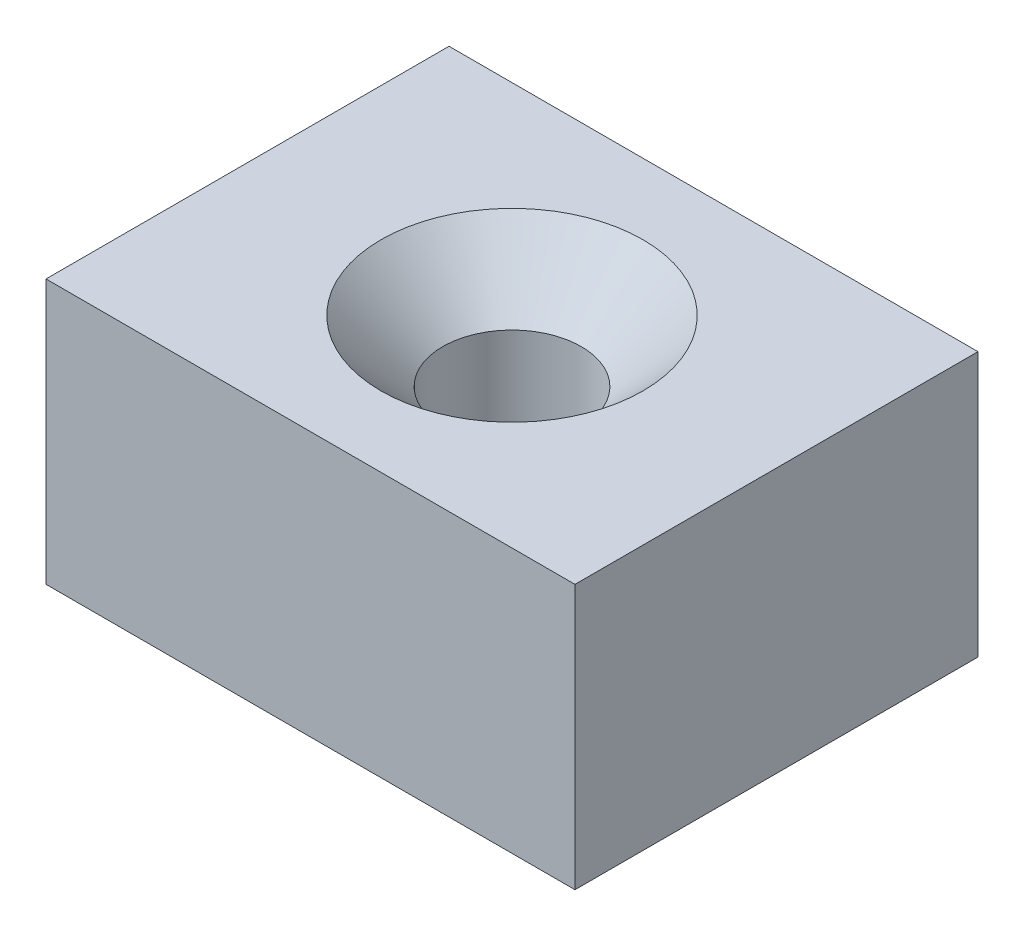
SolidWorks part; units mm, degrees
ref_plane "Front Plane" through (0, 0, 0) normal (0, 0, 1) x (1, 0, 0)
ref_plane "Top Plane" through (0, 0, 0) normal (0, 1, 0) x (1, 0, 0)
ref_plane "Right Plane" through (0, 0, 0) normal (1, 0, 0) x (0, 0, -1)
sketch "Sketch1" plane through (0, 0, 0) normal (0, 0, 1) x (1, 0, 0)
  line L1 (-10.5, 5.25) -> (10.5, 5.25)
  line L2 (-10.5, 5.25) -> (-10.5, -5.25)
  line L3 (-10.5, -5.25) -> (10.5, -5.25)
  line L4 (10.5, 5.25) -> (10.5, -5.25)
  line L5 (-10.5, 5.25) -> (10.5, -5.25) construction
  line L6 (-10.5, -5.25) -> (10.5, 5.25) construction
  point P0 (0, 0)
  dimension "D1" = 21
  dimension "D2" = 10.5
extrude "Boss-Extrude1" add sketch "Sketch1" along normal blind 16
hole_wizard "CSK for M5 Countersunk Flat Head Screw1" positions "Sketch3" profile "Sketch2" countersink size "M5" standard "ISO"
sketch "Sketch3" plane through (0, 5.25, 0) normal (0, 1, 0) x (1, 0, 0)
  line L0 (-10.5, 0) -> (10.5, -16) construction
  point P0 (0, -8)
  point P8 (0, -8)
sketch "Sketch2" plane through (0, 5.25, 8) normal (1, 0, 0) x (0, 0, 1)
  line L0 (0, 0) -> (0, 10.5)
  line L1 (0, 10.5) -> (2.75, 10.5)
  line L2 (2.75, 10.5) -> (2.75, 2.45)
  line L3 (2.75, 2.45) -> (5.2, 0)
  line L5 (5.2, 0) -> (0, 0)
  line L6 (-2.75, 2.45) -> (-5.2, 0) construction
  line L11 (0, -6.35) -> (0, 107.95) construction
  dimension "Thru Hole Dia." = 5.5
  dimension "Thru Hole Depth" = 10.5
  dimension "Near C'Sink Dia." = 10.4
  dimension "Near C'Sink Angle" = 90
